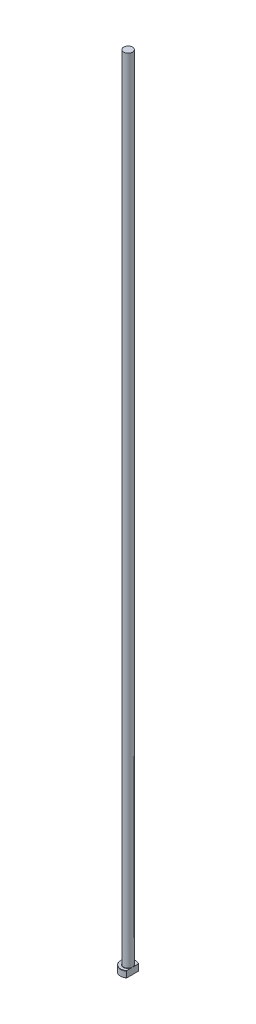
SolidWorks part; units mm, degrees
ref_plane "Front Plane" through (0, 0, 0) normal (0, 0, 1) x (1, 0, 0)
ref_plane "Top Plane" through (0, 0, 0) normal (0, 1, 0) x (1, 0, 0)
ref_plane "Right Plane" through (0, 0, 0) normal (1, 0, 0) x (0, 0, -1)
sketch "Sketch1" plane through (0, 0, 0) normal (0, 0, 1) x (1, 0, 0)
  line L0 (0, 259.9588) -> (0, -15.1925) construction
  line L1 (0, 0) -> (-6, 0)
  line L2 (-6, 0) -> (-6, 5)
  line L3 (-6, 5) -> (-3.5, 5)
  line L4 (-3.5, 5) -> (-3.5, 630)
  line L5 (-3.5, 630) -> (0, 630)
  line L6 (0, 630) -> (0, 0)
  dimension "L" = 630
  dimension "H" = 12
  dimension "T" = 5
  dimension "D" = 7
revolve "Revolve1" add sketch "Sketch1" angle 360 about L0
chamfer "Chamfer1" distance 0.2 angle 45 2 edges at (0, 5, 6) (0, 0, 6)
fillet "Fillet1" radius 0.2 1 edges at (0, 5, 3.5)
sketch "Sketch2" plane through (0, 0, 0) normal (0, 1, 0) x (1, 0, 0)
  line L0 (3.5, 4.8734) -> (3.5, -4.8734)
  circle A0 centre (0, 0) radius 6 construction
  arc A1 (3.5, -4.8734) -> (3.5, 4.8734) centre (0, 0) ccw
  circle A2 centre (0, 0) radius 3.5 construction
extrude "KEY" cut sketch "Sketch2" along normal through all
